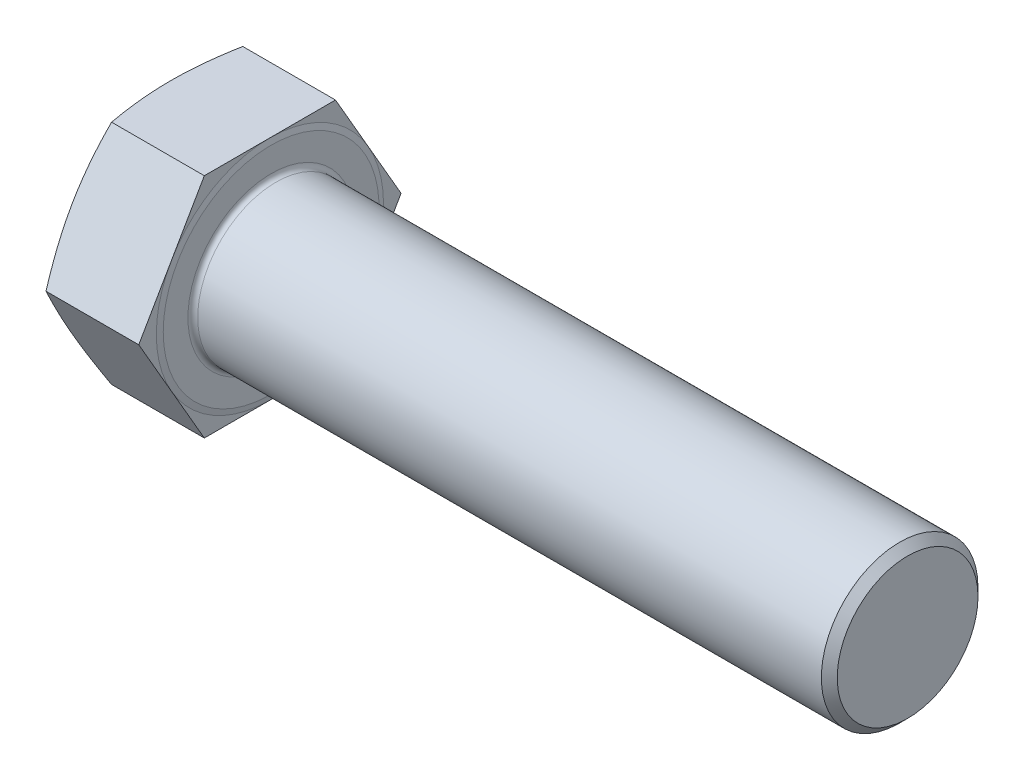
SolidWorks part; units mm, degrees
ref_plane "Front" through (0, 0, 0) normal (0, 0, 1) x (1, 0, 0)
ref_plane "Top" through (0, 0, 0) normal (0, 1, 0) x (1, 0, 0)
ref_plane "Right" through (0, 0, 0) normal (1, 0, 0) x (0, 0, -1)
sketch "Sketch-BaseHead" plane through (0, 0, 0) normal (1, 0, 0) x (0, 0, -1)
  line L1 (53.5781, 0) -> (26.7891, 46.4)
  line L2 (26.7891, 46.4) -> (-26.7891, 46.4)
  line L3 (-26.7891, 46.4) -> (-53.5781, 0)
  line L4 (-53.5781, 0) -> (-26.7891, -46.4)
  line L5 (-26.7891, -46.4) -> (26.7891, -46.4)
  line L6 (26.7891, -46.4) -> (53.5781, 0)
  circle A0 centre (0, 0) radius 46.4 construction
  dimension "s" = 92.8
extrude "BaseHead" add sketch "Sketch-BaseHead" along normal blind 40.5
sketch "Sketch4" plane through (-0.2646, 0, 5.9169) normal (0, 1, 0) x (0, 0, -1)
  line L0 (5.9169, 3.7369) -> (5.9169, -10.4477) construction
  line L2 (59.495, -0.2646) -> (52.3169, -0.2646)
  line L4 (52.3169, -0.2646) -> (59.495, -2.8773)
  line L6 (59.495, -2.8773) -> (59.495, -0.2646)
  dimension "D1" = 20
  dimension "D2" = 92.8
revolve "HeadChamfer" cut sketch "Sketch4" angle 360 about L0
sketch "Sketch1" plane through (0, 0, 0) normal (0, 0, 1) x (1, 0, 0)
  line L0 (40.5, 0) -> (41, 0)
  line L1 (41, 0) -> (41, -44.08)
  line L2 (41, -44.08) -> (40.5, -46.4)
  line L3 (40.5, -46.4) -> (40.5, 0) construction
  line L4 (0, 0) -> (7.5821, 0) construction
  line L5 (-4.0016, 0) -> (10.1831, 0) construction
  line L6 (40.5, -46.4) -> (2.6126, -46.4) construction
  line L7 (40.5, 0) -> (40.5, -46.4)
  dimension "D1" = 46.4
  dimension "c" = 0.5
  dimension "D2" = 44.08
revolve "Revolve1" add sketch "Sketch1" angle 360 about axis through (-4.0016, 0, 0) along (1, 0, 0)
ref_plane "Plane2" through (148, 0, 0) normal (1, 0, 0) x (0, 0, -1)
sketch "Sketch3" plane through (41, 0, 0) normal (1, 0, 0) x (0, 0, -1)
  circle A0 centre (0, 0) radius 32
  dimension "d" = 64
extrude "BaseBody" add sketch "Sketch3" along normal blind 260
fillet "HeadFillet" radius 2 1 edges at (41, 0, -32)
chamfer "Chamfer1" distance 3.2475 angle 45 1 edges at (301, 0, -32)
equation "\"D1@Sketch1\" = \"s@Sketch-BaseHead\"/ 2"
equation "\"D2@Sketch4\" = \"s@Sketch-BaseHead\""
equation "\"D1@Chamfer1\" =  ( \"d@Sketch3\" - \"D2@ThreadCosmetic1\" ) / 2 "
equation "\"b@ThreadCosmetic1\" = \"l@BaseBody\" - \"lg@Plane2\""
